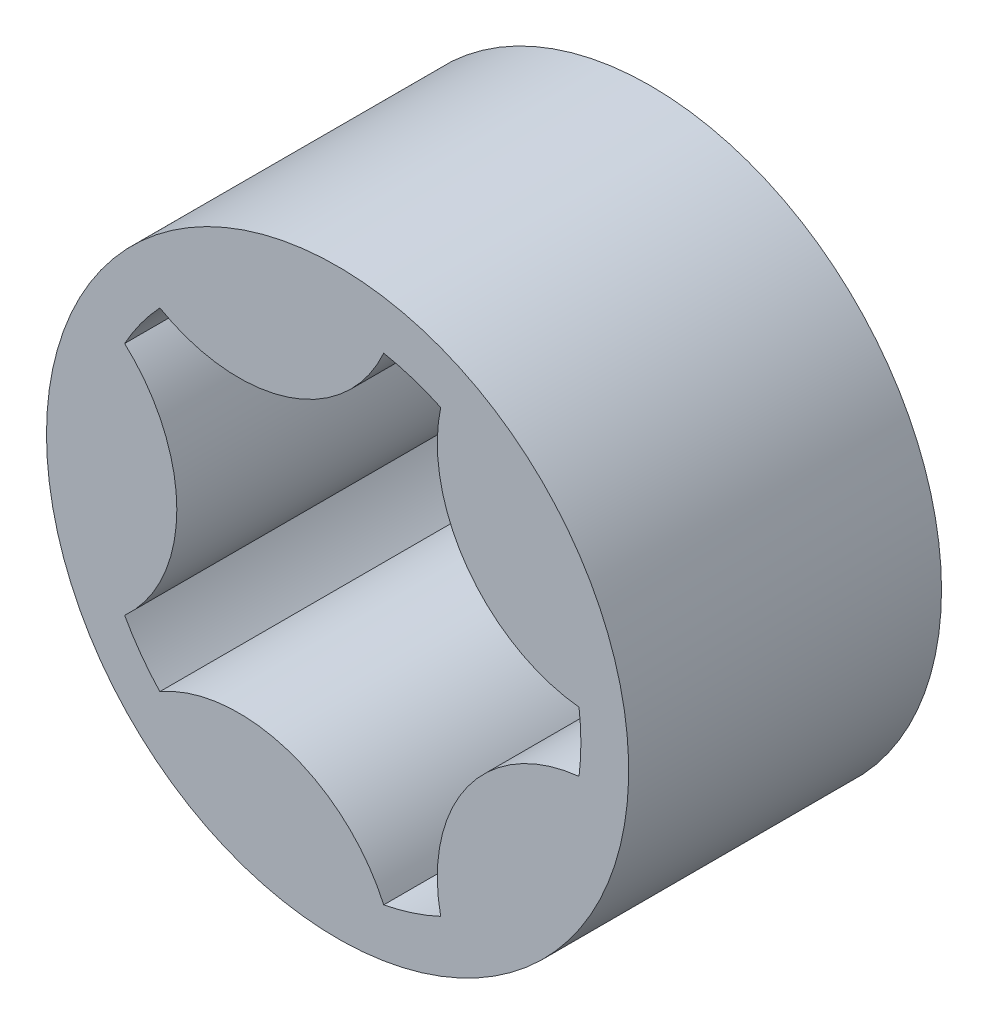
SolidWorks part; units mm, degrees
ref_plane "前视基准面" through (0, 0, 0) normal (0, 0, 1) x (1, 0, 0)
ref_plane "上视基准面" through (0, 0, 0) normal (0, 1, 0) x (1, 0, 0)
ref_plane "右视基准面" through (0, 0, 0) normal (1, 0, 0) x (0, 0, -1)
sketch "草图1" plane through (0, 0, 0) normal (0, 0, 1) x (1, 0, 0)
  line L0 (0, 0) -> (-10.9548, 0) construction
  circle A0 centre (0, 0) radius 33.5
  circle A1 centre (0, 0) radius 33.5 construction
  arc A2 (-20.4548, 19.1207) -> (-24.5057, 13.5451) centre (0, 0) ccw
  arc A3 (-24.5057, 13.5451) -> (-24.5057, -13.5451) centre (-36.7773, 0) cw
  arc A5 (-15.3709, 4.1031) -> (-15.3709, -4.1031) centre (-14.2453, 0) ccw construction
  arc A6 (5.3094, 27.492) -> (-20.4548, 19.1207) centre (-11.3648, 34.9773) cw
  arc A7 (27.7871, 3.4459) -> (11.864, 25.3623) centre (29.7535, 21.6172) cw
  arc A8 (11.864, -25.3623) -> (27.7871, -3.4459) centre (29.7535, -21.6172) cw
  arc A15 (-20.4548, -19.1207) -> (5.3094, -27.492) centre (-11.3648, -34.9773) cw
  arc A19 (8.6031, 19.8709) -> (24.3709, 4.1031) centre (30.331, 25.831) ccw construction
  arc A20 (-24.5057, -13.5451) -> (-20.4548, -19.1207) centre (0, 0) ccw
  arc A21 (5.3094, -27.492) -> (11.864, -25.3623) centre (0, 0) ccw
  arc A22 (27.7871, -3.4459) -> (27.7871, 3.4459) centre (0, 0) ccw
  arc A23 (11.864, 25.3623) -> (5.3094, 27.492) centre (0, 0) ccw
  dimension "D1" = 56
extrude "拉伸1" add sketch "草图1" along normal up to surface (36 mm away)
